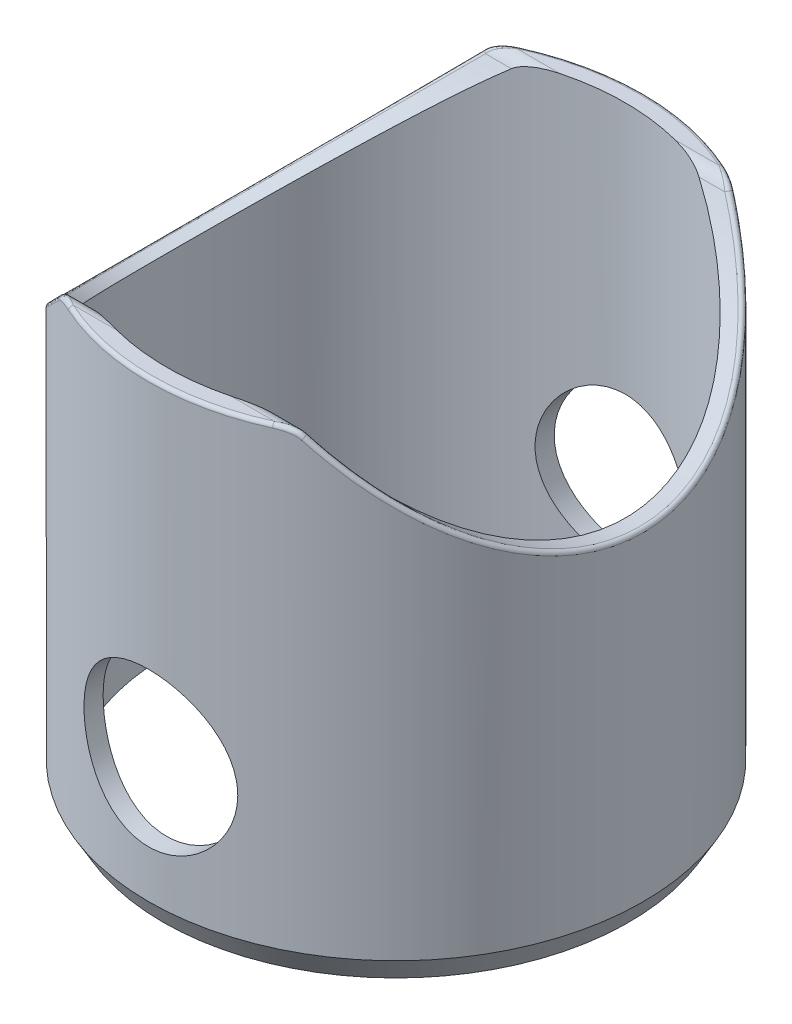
SolidWorks part; units mm, degrees
ref_plane "Ebene vorne" through (0, 0, 0) normal (0, 0, 1) x (1, 0, 0)
ref_plane "Ebene oben" through (0, 0, 0) normal (0, 1, 0) x (1, 0, 0)
ref_plane "Ebene rechts" through (0, 0, 0) normal (1, 0, 0) x (0, 0, -1)
ref_plane "Ebene1" through (0, 134.5, 0) normal (0, 1, 0) x (-1, 0, 0)
sketch "Skizze1" plane through (0, 134.5, 0) normal (0, 1, 0) x (1, 0, 0)
  circle A0 centre (0, 0) radius 15.8
  circle A1 centre (0, 0) radius 17.05
extrude "Aufsatz-Linear austragen1" add sketch "Skizze1" along normal blind 40
sketch "Skizze2" plane through (0, 0, 0) normal (1, 0, 0) x (0, 0, -1)
  line L0 (-15.3039, 167.5) -> (-25.0069, 167.5)
  line L1 (-35.0069, 177.5) -> (-35.0069, 197.5)
  line L2 (-25.0069, 207.5) -> (24.9931, 207.5)
  line L3 (34.9931, 197.5) -> (34.9931, 177.5)
  line L4 (-35.0069, 175) -> (34.9931, 175) construction
  line L5 (15.2902, 167.5) -> (24.9931, 167.5)
  line L6 (-0.0069, 175) -> (-0.0069, 134.5) construction
  circle A0 centre (-0.0069, 175) radius 16.5 construction
  arc A1 (-14.4298, 166.9857) -> (14.4161, 166.9857) centre (-0.0069, 175) ccw
  arc A2 (-25.0069, 167.5) -> (-35.0069, 177.5) centre (-25.0069, 177.5) cw
  arc A3 (24.9931, 167.5) -> (34.9931, 177.5) centre (24.9931, 177.5) ccw
  arc A4 (24.9931, 207.5) -> (34.9931, 197.5) centre (24.9931, 197.5) cw
  arc A5 (-35.0069, 197.5) -> (-25.0069, 207.5) centre (-25.0069, 197.5) cw
  arc A6 (-15.3039, 167.5) -> (-14.4298, 166.9857) centre (-15.3039, 166.5) cw
  arc A7 (14.4161, 166.9857) -> (15.2902, 167.5) centre (15.2902, 166.5) cw
  dimension "D1" = 10
  dimension "D2" = 10
  dimension "D3" = 1
  dimension "D4" = 1
extrude "Schnitt-Linear austragen2" cut sketch "Skizze2" against normal through all and the other way through all
chamfer "Fase1" distance 1 angle 60 1 edges at (0, 134.5, 17.05)
fillet "Verrundung1" radius 0.25 8 edges at (8.7155, 167.2601, 14.6541) (-8.645, 167.2938, 14.6958) (16.951, 158.6031, -1.8346) (-16.949, 158.6037, 1.8535) (8.6643, 167.2956, -14.6844) (-8.7379, 167.2604, -14.6408) (0, 167.5, -17.05) (0, 167.5, 17.05)
sketch "Skizze3" plane through (0, 0, 0) normal (0, 0, 1) x (1, 0, 0)
  circle A0 centre (0, 144.8) radius 5.3
extrude "Schnitt-Linear austragen3" cut sketch "Skizze3" against normal through all and the other way through all
